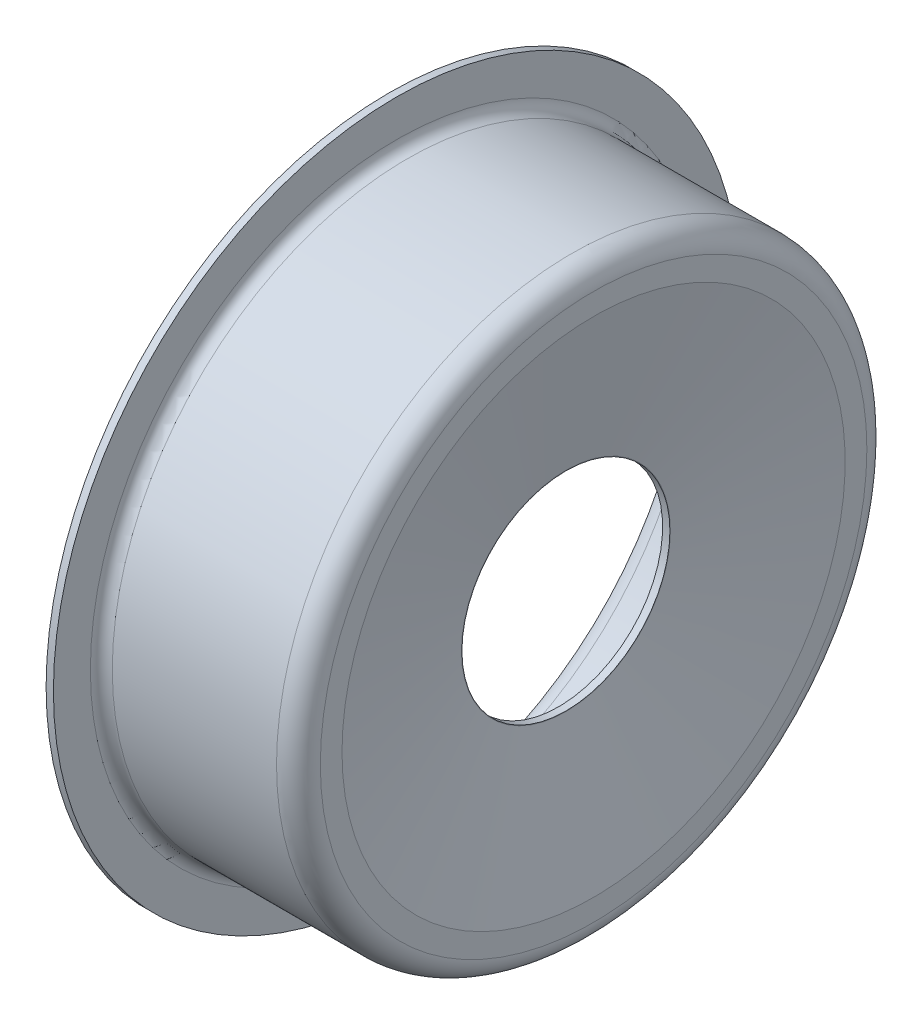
SolidWorks part; units mm, degrees
ref_plane "Front" through (0, 0, 0) normal (0, 0, 1) x (1, 0, 0)
ref_plane "Top" through (0, 0, 0) normal (0, 1, 0) x (1, 0, 0)
ref_plane "Right" through (0, 0, 0) normal (1, 0, 0) x (0, 0, -1)
sketch "Sketch1" plane through (0, 0, 0) normal (0, 0, 1) x (1, 0, 0)
  line L0 (54.291, 47) -> (54.291, 41.9355)
  line L1 (54.291, -47) -> (54.291, 47) construction
  line L2 (55.791, 40.4355) -> (78.291, 40.4355)
  line L3 (81.291, 37.4355) -> (81.291, 34.4657)
  line L4 (81.291, 34.4657) -> (77.5, 14.3176)
  line L5 (77.5, -23.6291) -> (77.5, 23.6291) construction
  line L6 (0, 0) -> (88.5038, 0) construction
  line L7 (77.5, 14.3176) -> (77.5, 0)
  arc A0 (78.291, 40.4355) -> (81.291, 37.4355) centre (78.291, 37.4355) cw
  arc A1 (54.291, 41.9355) -> (55.791, 40.4355) centre (55.791, 41.9355) ccw
  point P16 (81.291, 40.4355)
  point P19 (54.291, 40.4355)
  dimension "D2" = 3
  dimension "D3" = 1.5
  dimension "D1" = 27
revolve "Revolve-Thin1" add sketch "Sketch1" angle 360 about L6
sketch "Sketch2" plane through (76.5, 0, 0) normal (-1, 0, 0) x (0, 0, 1)
  circle A0 centre (0, 0) radius 14.25
  dimension "D1" = 28.5
extrude "Cut-Extrude1" cut sketch "Sketch2" against normal blind 2.311
